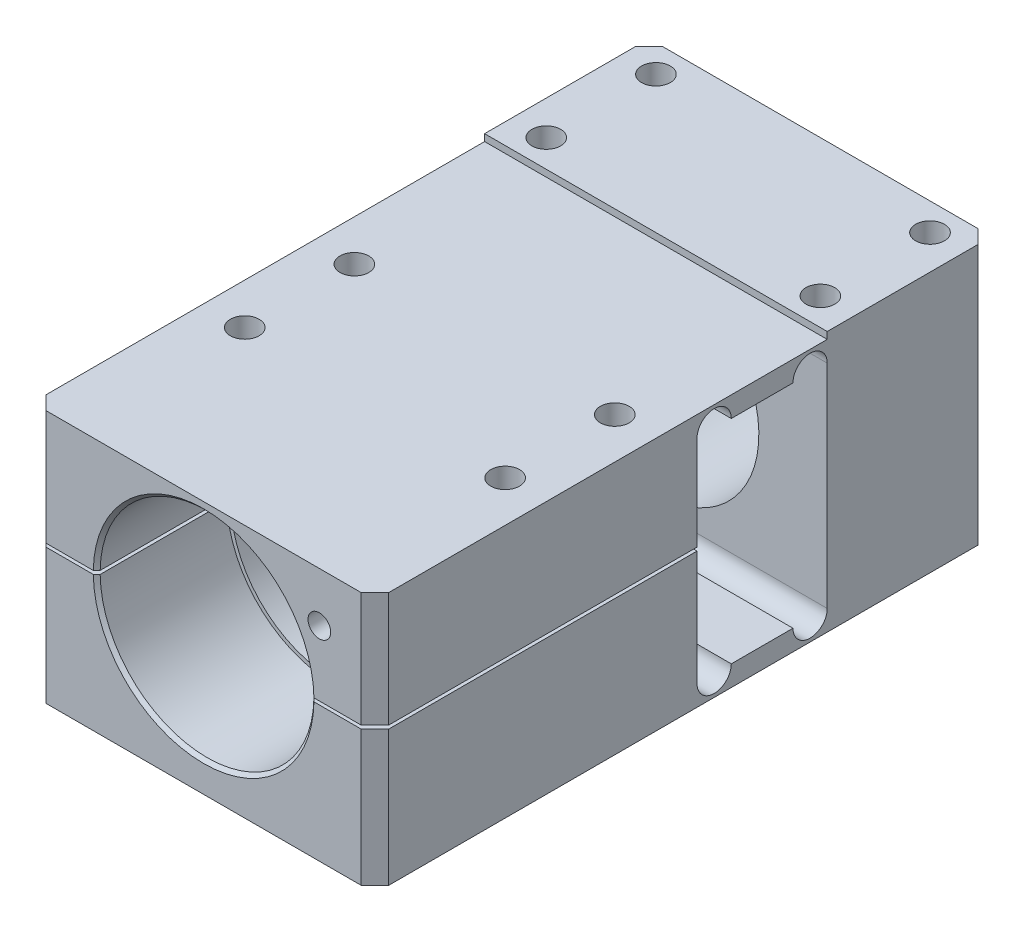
SolidWorks part; units mm, degrees
ref_plane "Plan1" through (0, 0, 0) normal (0, 0, 1) x (1, 0, 0)
ref_plane "Plan2" through (0, 0, 0) normal (0, 1, 0) x (1, 0, 0)
ref_plane "Plan3" through (0, 0, 0) normal (1, 0, 0) x (0, 0, -1)
sketch "Esquisse1" plane through (0, 0, 0) normal (0, 0, 1) x (1, 0, 0)
  line L0 (0, 51.1183) -> (0, -45.4596) construction
  line L1 (-25, 18) -> (25, 18)
  line L2 (-25, 18) -> (-25, -20)
  line L3 (-25, -20) -> (25, -20)
  line L4 (25, 18) -> (25, -20)
  line L5 (0, -20.9) -> (0, 20.9) construction
  line L6 (28.6, 0) -> (-28.6, 0) construction
  dimension "D2" = 18
  dimension "D3" = 20
  dimension "D4" = 50
extrude "Boss.-Extru.1" add sketch "Esquisse1" along normal blind 90
sketch "Esquisse10" plane through (0, 0, 0) normal (1, 0, 0) x (0, 0, -1)
  line L0 (10.5124, 0) -> (-70.9695, 0) construction
  line L1 (27.5, 0) -> (-27.5, 0) construction
  line L2 (0, 0) -> (0, 15.025)
  line L3 (0, 15.025) -> (-71, 15.025)
  line L4 (-71, 15.025) -> (-71, 15.6)
  line L5 (-71, 15.6) -> (-90, 15.6)
  line L8 (-90, 15.6) -> (-90, 0)
  line L9 (-90, 0) -> (0, 0)
  line L10 (-90, 18) -> (-90, -20) construction
  line L11 (0, 18) -> (0, -20) construction
  dimension "D1" = 30.05
  dimension "D2" = 31.2
  dimension "D3" = 19
revolve "Enlèvement de matière-Révolution1" cut sketch "Esquisse10" angle 360 about L0
sketch "Esquisse13" plane through (0, 0, 0) normal (1, 0, 0) x (0, 0, -1)
  line L0 (-90, -20) -> (-90, 18) construction
  line L1 (-38, 14) -> (-29, 14)
  line L2 (-43, 14) -> (-43, -17)
  line L3 (-38, -17) -> (-29, -17)
  line L4 (-24, 14) -> (-24, -17)
  line L5 (0, -20) -> (0, 18) construction
  line L6 (-90, 18) -> (0, 18) construction
  line L7 (-90, 18) -> (-24, 18)
  line L8 (-90, 18) -> (-90, 17)
  line L9 (-90, 17) -> (-24, 17)
  line L10 (-24, 18) -> (-24, 17)
  line L11 (-90, -20) -> (0, -20) construction
  arc A0 (-43, 14) -> (-38, 14) centre (-40.5, 14) cw
  arc A1 (-24, 14) -> (-29, 14) centre (-26.5, 14) ccw
  arc A2 (-43, -17) -> (-38, -17) centre (-40.5, -17) ccw
  arc A3 (-24, -17) -> (-29, -17) centre (-26.5, -17) cw
  dimension "D1" = 47
  dimension "D2" = 24
  dimension "D3" = 1
  dimension "D6" = 3
extrude "Enlèv. mat.-Extru.1" cut sketch "Esquisse13" against normal through all both and the other way through all
sketch "Esquisse5" plane through (0, 0, 90) normal (0, 0, -1) x (-1, 0, 0)
  line L0 (-53.0779, 0) -> (53.0779, 0)
extrude "Enlèv. de mat.-Extru.-Mince1" cut sketch "Esquisse5" along normal blind 50 thin
hole_wizard "Chambrage pour vis à tête hexagonale M51" positions "Esquisse6" profile "Esquisse7" counterbore size "M5" standard "ISO"
sketch "Esquisse6" plane through (0, -20, 0) normal (0, -1, 0) x (-1, 0, 0)
  line L7 (46.8637, -57) -> (-34.8237, -57) construction
  line L9 (-15.598, -71) -> (15.598, -71) construction
  line L10 (15.0229, -43) -> (5.4544, -43) construction
  line L11 (0, 20.9) -> (0, -20.9) construction
  line L12 (0, -98.4255) -> (0, -14.1552) construction
  point P0 (19, -49)
  point P2 (19, -65)
  point P34 (-19, -65)
  point P35 (-19, -49)
  dimension "D1" = 16
  dimension "D2" = 19
sketch "Esquisse7" plane through (-19, -20, 49) normal (1, 0, 0) x (0, 0, -1)
  line L0 (0, 0) -> (0, 21.4014)
  line L1 (0, 21.4014) -> (2.75, 19.749)
  line L2 (2.75, 19.749) -> (2.75, 5.4)
  line L3 (2.75, 5.4) -> (5, 5.4)
  line L4 (5, 5.4) -> (5, 0)
  line L5 (5, 0) -> (0, 0)
  line L10 (0, 21.4014) -> (-2.75, 19.749) construction
  line L11 (0, -6.35) -> (0, 107.95) construction
  dimension "Diamètre du perçage" = 5.5
  dimension "Profondeur du perçage" = 19.749
  dimension "Diamètre du chambrage" = 10
  dimension "Profondeur du chambrage" = 5.4
  dimension "Angle de pointe" = 118
hole_wizard "Trou taraudé M51" positions "Esquisse8" profile "Esquisse9" tap size "M5" standard "ISO"
sketch "Esquisse8" plane through (0, 0.25, 0) normal (0, -1, 0) x (-1, 0, 0)
  circle A0 centre (19, -49) radius 2.75 construction
  point P0 (19, -49)
  point P3 (19, -65)
  point P12 (-19, -65)
  point P15 (-19, -49)
sketch "Esquisse9" plane through (-19, 0.25, 49) normal (1, 0, 0) x (0, 0, -1)
  line L0 (0, 0) -> (0, 17.75)
  line L1 (0, 17.75) -> (2.1, 17.75)
  line L2 (2.1, 17.75) -> (2.1, 0)
  line L5 (2.1, 0) -> (0, 0)
  line L11 (0, -6.35) -> (0, 107.95) construction
  dimension "Diamètre du trou pour taraudage jusqu'au prochain" = 4.2
  dimension "Profondeur du trou pour taraudage jusqu'au prochain" = 17.75
hole_wizard "Trou taraudé M41" positions "Esquisse11" profile "Esquisse12" tap size "M4" standard "ISO"
sketch "Esquisse11" plane through (0, 0, 90) normal (0, 0, 1) x (1, 0, 0)
  line L0 (0, 0) -> (16.8875, 9.75)
  line L2 (0, -20.9) -> (0, 20.9) construction
  circle A0 centre (0, 0) radius 19.5
  point P4 (16.8875, 9.75)
  dimension "D1" = 39
  dimension "D2" = 60
sketch "Esquisse12" plane through (16.8875, 9.75, 90) normal (1, 0, 0) x (0, -1, 0)
  line L0 (0, 0) -> (0, 11.0914)
  line L1 (0, 11.0914) -> (1.65, 10.1)
  line L2 (1.65, 10.1) -> (1.65, 0)
  line L5 (1.65, 0) -> (0, 0)
  line L10 (0, 11.0914) -> (-1.65, 10.1) construction
  line L11 (0, -6.35) -> (0, 107.95) construction
  dimension "Diamètre du trou pour taraudage" = 3.3
  dimension "Profondeur du trou pour taraudage" = 10.1
  dimension "Angle de pointe" = 118
hole_wizard "Trou taraudé M52" positions "Esquisse14" profile "Esquisse15" tap size "M5" standard "ISO"
sketch "Esquisse14" plane through (0, 18, 0) normal (0, 1, 0) x (1, 0, 0)
  line L0 (0, 9.0002) -> (0, -12) construction
  line L1 (0, -12) -> (-30.9043, -12) construction
  line L3 (0, -20.9) -> (0, 20.9) construction
  line L4 (-25, -24) -> (25, -24) construction
  line L5 (25, 0) -> (-25, 0) construction
  point P0 (-20, -4)
  point P2 (-20, -20)
  point P19 (20, -20)
  point P20 (20, -4)
  dimension "D1" = 16
  dimension "D2" = 40
sketch "Esquisse15" plane through (-20, 18, 4) normal (1, 0, 0) x (0, 0, 1)
  line L0 (0, 0) -> (0, 15.6618)
  line L1 (0, 15.6618) -> (2.1, 14.4)
  line L2 (2.1, 14.4) -> (2.1, 0)
  line L5 (2.1, 0) -> (0, 0)
  line L10 (0, 15.6618) -> (-2.1, 14.4) construction
  line L11 (0, -6.35) -> (0, 107.95) construction
  dimension "Diamètre du trou pour taraudage" = 4.2
  dimension "Profondeur du trou pour taraudage" = 14.4
  dimension "Angle de pointe" = 118
chamfer "Chanfrein1" distance 2 angle 45 6 edges at (-25, 8.625, 90) (-25, -10.125, 90) (25, -10.125, 90) (25, 8.625, 90) (25, -1, 0) (-25, -1, 0)
chamfer "Chanfrein2" distance 0.5 angle 45 3 edges at (0, -15.6, 90) (0, 15.6, 90) (-15.025, 0, 0)
